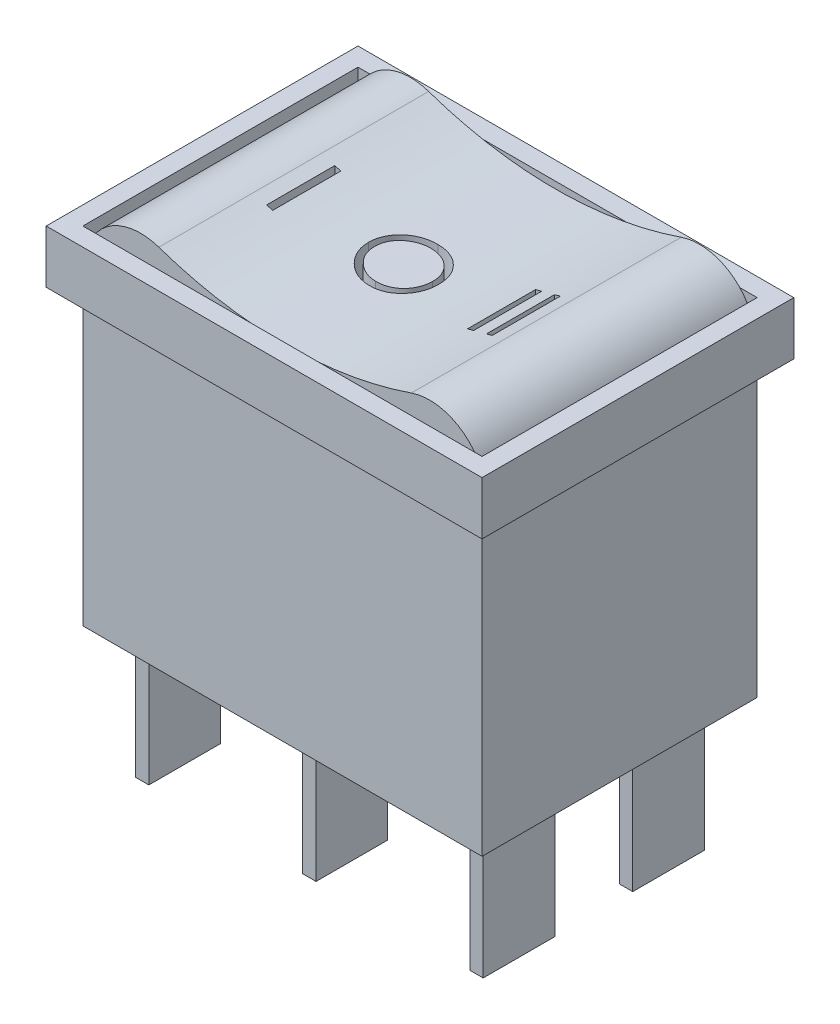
SolidWorks part; units mm, degrees
ref_plane "Front Plane" through (0, 0, 0) normal (0, 0, 1) x (1, 0, 0)
ref_plane "Top Plane" through (0, 0, 0) normal (0, 1, 0) x (1, 0, 0)
ref_plane "Right Plane" through (0, 0, 0) normal (1, 0, 0) x (0, 0, -1)
sketch "Sketch1" plane through (0, 0, 0) normal (0, 1, 0) x (1, 0, 0)
  line L1 (9.5441, -6.5786) -> (-9.544, -6.5786)
  line L2 (9.5441, -6.5786) -> (9.5441, 6.5786)
  line L3 (9.5441, 6.5786) -> (-9.544, 6.5786)
  line L4 (-9.544, -6.5786) -> (-9.544, 6.5786)
  line L5 (9.5441, -6.5786) -> (-9.544, 6.5786) construction
  line L6 (9.5441, 6.5786) -> (-9.544, -6.5786) construction
  point P0 (0, 0)
  dimension "D1" = 19.0881
  dimension "D2" = 13.1572
extrude "Boss-Extrude1" add sketch "Sketch1" along normal blind 15.2908
sketch "Sketch2" plane through (0, 15.2908, 0) normal (0, 1, 0) x (1, 0, 0)
  line L0 (-10.4203, -7.4549) -> (10.4204, -7.4549)
  line L1 (10.4204, -7.4549) -> (10.4204, 7.4549)
  line L2 (10.4204, 7.4549) -> (-10.4203, 7.4549)
  line L3 (-10.4203, 7.4549) -> (-10.4203, -7.4549)
  line L4 (-9.544, 6.5786) -> (-9.544, -6.5786)
  line L5 (-9.544, -6.5786) -> (9.5441, -6.5786)
  line L6 (9.5441, -6.5786) -> (9.5441, 6.5786)
  line L7 (9.5441, 6.5786) -> (-9.544, 6.5786)
  line L8 (-9.544, 6.5786) -> (-9.544, -6.5786)
  line L9 (-9.544, -6.5786) -> (9.5441, -6.5786)
  line L10 (9.5441, -6.5786) -> (9.5441, 6.5786)
  line L11 (9.5441, 6.5786) -> (-9.544, 6.5786)
  dimension "D2" = 14.9098
  dimension "D1" = 0
extrude "Boss-Extrude2" add sketch "Sketch2" along normal blind 1.27 and the other way blind 1.27
sketch "Sketch3" plane through (0, 0, 0) normal (0, 0, 1) x (1, 0, 0)
  line L0 (-6.0377, 17.372) -> (0, 15.2908) construction
  line L1 (0, 15.2908) -> (6.0377, 17.372) construction
  line L6 (-9.544, 15.2908) -> (9.5441, 15.2908)
  line L7 (-6.0377, 17.372) -> (6.0377, 17.372) construction
  arc A0 (-9.544, 15.2908) -> (-6.0377, 17.372) centre (-6.9087, 14.8452) cw
  arc A1 (6.0377, 17.372) -> (9.5441, 15.2908) centre (6.9087, 14.8452) cw
  arc A2 (-6.0377, 17.372) -> (6.0377, 17.372) centre (0, 34.8876) ccw
extrude "Boss-Extrude3" add sketch "Sketch3" along normal offset from surface 0.127 and the other way offset from surface (6.4516 mm away) 0.127 contours L6 A1 L1 L0 A0
sketch "Sketch4" plane through (0, 0, 0) normal (0, -1, 0) x (1, 0, 0)
  line L1 (7.994, -3.5756) -> (-7.994, -3.5756) construction
  line L2 (7.994, -3.5756) -> (7.994, 3.5756) construction
  line L3 (7.994, 3.5756) -> (-7.994, 3.5756) construction
  line L4 (-7.994, -3.5756) -> (-7.994, 3.5756) construction
  line L5 (7.994, -3.5756) -> (-7.994, 3.5756) construction
  line L6 (7.994, 3.5756) -> (-7.994, -3.5756) construction
  line L7 (-8.3115, 1.8611) -> (-7.6765, 1.8611)
  line L8 (-8.3115, 1.8611) -> (-8.3115, 5.2901)
  line L9 (-8.3115, 5.2901) -> (-7.6765, 5.2901)
  line L10 (-7.6765, 1.8611) -> (-7.6765, 5.2901)
  line L11 (-8.3115, 1.8611) -> (-7.6765, 5.2901) construction
  line L12 (-8.3115, 5.2901) -> (-7.6765, 1.8611) construction
  line L13 (-0.3175, 1.8611) -> (0.3175, 1.8611)
  line L14 (-0.3175, 1.8611) -> (-0.3175, 5.2901)
  line L15 (-0.3175, 5.2901) -> (0.3175, 5.2901)
  line L16 (0.3175, 1.8611) -> (0.3175, 5.2901)
  line L17 (-0.3175, 1.8611) -> (0.3175, 5.2901) construction
  line L18 (-0.3175, 5.2901) -> (0.3175, 1.8611) construction
  line L19 (7.6765, 1.8611) -> (8.3115, 1.8611)
  line L20 (7.6765, 1.8611) -> (7.6765, 5.2901)
  line L21 (7.6765, 5.2901) -> (8.3115, 5.2901)
  line L22 (8.3115, 1.8611) -> (8.3115, 5.2901)
  line L23 (7.6765, 1.8611) -> (8.3115, 5.2901) construction
  line L24 (7.6765, 5.2901) -> (8.3115, 1.8611) construction
  line L25 (-7.6765, -5.2901) -> (-8.3115, -5.2901)
  line L26 (-7.6765, -5.2901) -> (-7.6765, -1.8611)
  line L27 (-7.6765, -1.8611) -> (-8.3115, -1.8611)
  line L28 (-8.3115, -5.2901) -> (-8.3115, -1.8611)
  line L29 (-7.6765, -5.2901) -> (-8.3115, -1.8611) construction
  line L30 (-7.6765, -1.8611) -> (-8.3115, -5.2901) construction
  line L31 (0.3175, -5.2901) -> (-0.3175, -5.2901)
  line L32 (0.3175, -5.2901) -> (0.3175, -1.8611)
  line L33 (0.3175, -1.8611) -> (-0.3175, -1.8611)
  line L34 (-0.3175, -5.2901) -> (-0.3175, -1.8611)
  line L35 (0.3175, -5.2901) -> (-0.3175, -1.8611) construction
  line L36 (0.3175, -1.8611) -> (-0.3175, -5.2901) construction
  line L37 (8.3115, -1.8611) -> (7.6765, -1.8611)
  line L38 (8.3115, -1.8611) -> (8.3115, -5.2901)
  line L39 (8.3115, -5.2901) -> (7.6765, -5.2901)
  line L40 (7.6765, -1.8611) -> (7.6765, -5.2901)
  line L41 (8.3115, -1.8611) -> (7.6765, -5.2901) construction
  line L42 (8.3115, -5.2901) -> (7.6765, -1.8611) construction
  point P0 (0, 0)
  point P10 (0, 3.5756)
  point P23 (0, -3.5756)
  dimension "D1" = 0.635
  dimension "D2" = 3.429
extrude "Boss-Extrude4" add sketch "Sketch4" along normal offset from surface (6.2992 mm away) 22.86
sketch "Sketch5" plane through (0, 14.0208, 0) normal (0, 1, 0) x (1, 0, 0)
  line L0 (-6.0377, -1.9162) -> (6.0377, -1.9162) construction
  line L1 (-6.0377, -6.4516) -> (-6.0377, 6.4516) construction
  line L2 (6.0377, -6.4516) -> (6.0377, 6.4516) construction
  text T0 "l  O  ll" font "Century Gothic" height 3.175
extrude "Cut-Extrude1" cut sketch "Sketch5" along normal through all
